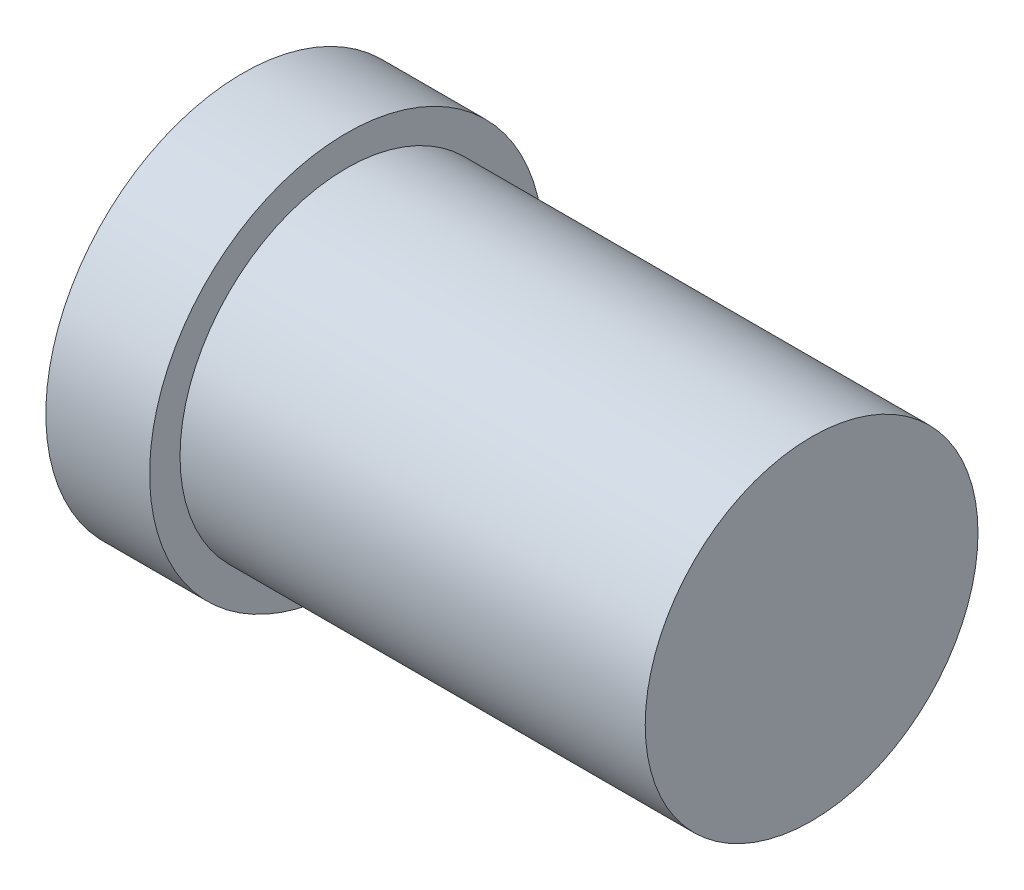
SolidWorks part; units mm, degrees
ref_plane "Front" through (0, 0, 0) normal (0, 0, 1) x (1, 0, 0)
ref_plane "Top" through (0, 0, 0) normal (0, 1, 0) x (1, 0, 0)
ref_plane "Right" through (0, 0, 0) normal (1, 0, 0) x (0, 0, -1)
sketch "Sketch1" plane through (0, 0, 0) normal (1, 0, 0) x (0, 0, -1)
  circle A0 centre (0, 0) radius 6.985
  dimension "D1" = 13.97
extrude "Extrude1" add sketch "Sketch1" against normal blind 3.683
sketch "Sketch2" plane through (0, 0, 0) normal (1, 0, 0) x (0, 0, -1)
  circle A0 centre (0, 0) radius 5.9055
  dimension "D1" = 11.811
extrude "Extrude2" add sketch "Sketch2" along normal blind 16.51
sketch "Sketch3" plane through (-3.683, 0, 0) normal (-1, 0, 0) x (0, 0, 1)
  circle A0 centre (0, 0) radius 5.9055
  dimension "D1" = 11.811
extrude "Cut-Extrude1" cut sketch "Sketch3" against normal blind 1.2446 draft 53.6
sketch "Sketch5" plane through (0, 0, 0) normal (0, 0, 1) x (1, 0, 0)
  line L0 (-2.4384, 0) -> (-3.683, 0) construction
  line L2 (-2.4384, 4.2174) -> (-2.4384, -4.2174) construction
  line L3 (-3.683, 6.985) -> (-3.683, -6.985) construction
  line L4 (-2.4384, 0) -> (-2.4384, 4.2174)
  line L5 (-2.4384, 0) -> (-3.683, 0)
  arc A0 (-3.683, 0) -> (-2.4384, 4.2174) centre (4.0846, 0) cw
revolve "Revolve1" add sketch "Sketch5" angle 360 about L0
